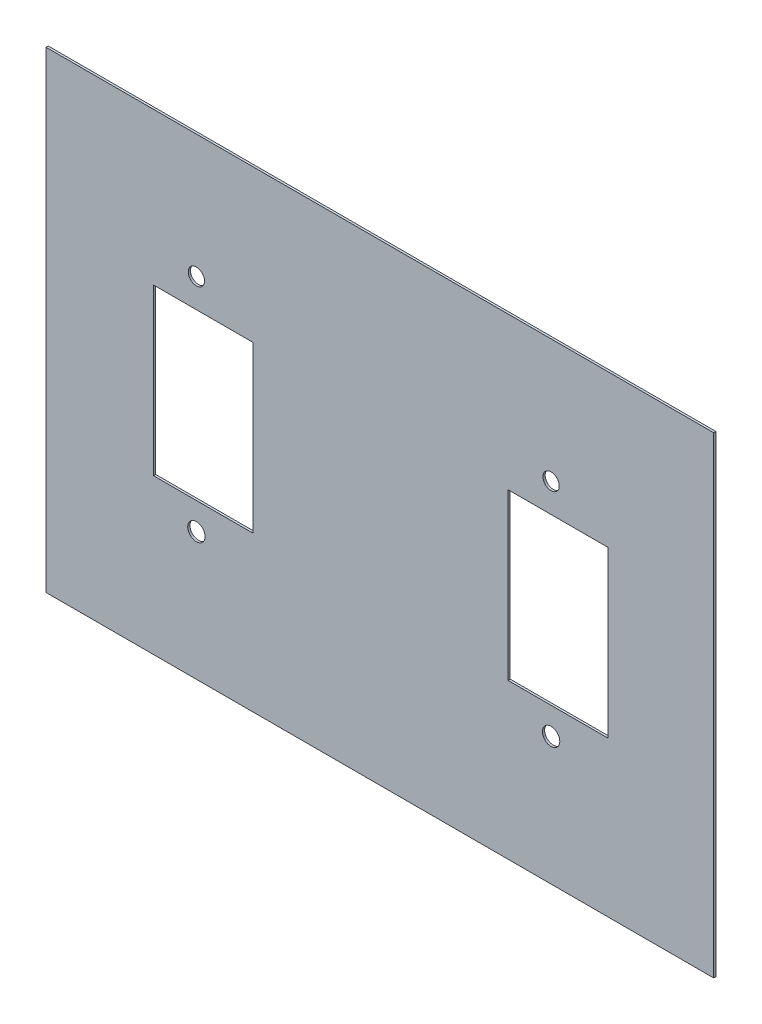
SolidWorks part; units mm, degrees
ref_plane "Front Plane" through (0, 0, 0) normal (0, 0, 1) x (1, 0, 0)
ref_plane "Top Plane" through (0, 0, 0) normal (0, 1, 0) x (1, 0, 0)
ref_plane "Right Plane" through (0, 0, 0) normal (1, 0, 0) x (0, 0, -1)
sketch "Sketch1" plane through (0, 0, 0) normal (0, 0, 1) x (1, 0, 0)
  line L1 (-292.9346, 286.4008) -> (472.0536, 286.4008)
  line L2 (-292.9346, 286.4008) -> (-292.9346, -795.6374)
  line L3 (-292.9346, -795.6374) -> (472.0536, -795.6374)
  line L4 (472.0536, 286.4008) -> (472.0536, -795.6374)
extrude "Extrude1" add sketch "Sketch1" along normal blind 2.54
sketch "Sketch2" plane through (0, 0, 2.54) normal (0, 0, 1) x (1, 0, 0)
  line L1 (-170.0737, 112.0966) -> (-55.6475, 112.0966)
  line L2 (-170.0737, 112.0966) -> (-170.0737, -77.1862)
  line L3 (-170.0737, -77.1862) -> (-55.6475, -77.1862)
  line L4 (-55.6475, 112.0966) -> (-55.6475, -77.1862)
extrude "Cut-Extrude1" cut sketch "Sketch2" against normal through all
sketch "Sketch3" plane through (0, 0, 2.54) normal (0, 0, 1) x (1, 0, 0)
  circle A0 centre (-120.6834, 145.099) radius 9.3347
  circle A1 centre (-120.6834, -108.0953) radius 9.9588
extrude "Cut-Extrude2" cut sketch "Sketch3" against normal through all
pattern_linear "LPattern1" count 2 spacing 762 along (0, -1, 0) count 3 spacing 203.2 along (1, 0, 0) of "Cut-Extrude1", "Cut-Extrude2"
sketch "Sketch4" plane through (0, 0, 2.54) normal (0, 0, 1) x (1, 0, 0)
  line L0 (-292.9346, -254.6183) -> (472.0536, -254.6183)
  line L1 (-292.9346, 286.4008) -> (-292.9346, -795.6374) construction
  line L2 (472.0536, -795.6374) -> (472.0536, 286.4008) construction
extrude "Cut-Extrude3" cut sketch "Sketch4" against normal through all and the other way through all flip side to cut
